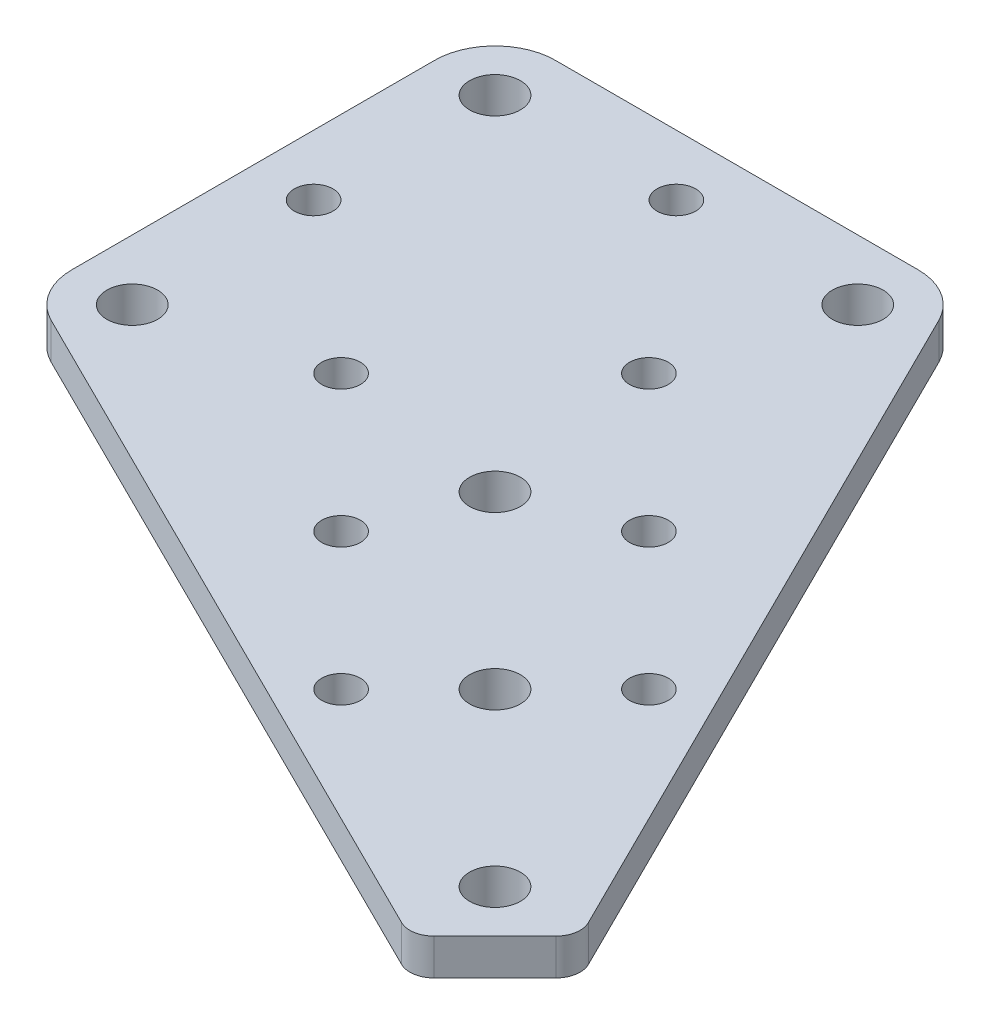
SolidWorks part; units mm, degrees
ref_plane "前视基准面" through (0, 0, 0) normal (0, 0, 1) x (1, 0, 0)
ref_plane "上视基准面" through (0, 0, 0) normal (0, 1, 0) x (1, 0, 0)
ref_plane "右视基准面" through (0, 0, 0) normal (1, 0, 0) x (0, 0, -1)
other "Configuration Table"
sketch "草图1" plane through (0, 0, 0) normal (0, 1, 0) x (1, 0, 0)
  line L0 (458.5965, -465.6676) -> (465.6676, -458.5965) construction
  line L1 (0, 0) -> (250, 0) construction
  line L2 (0, 0) -> (0, -250) construction
  line L3 (0, -250) -> (250, -250) construction
  line L4 (250, 0) -> (250, -250) construction
  line L5 (458.5965, -465.6676) -> (34.3324, -41.4035) construction
  line L6 (465.6676, -458.5965) -> (41.4035, -34.3324) construction
  line L7 (34.3324, -41.4035) -> (41.4035, -34.3324) construction
  line L8 (458.5965, -465.6676) -> (41.4035, -34.3324) construction
  line L9 (465.6676, -458.5965) -> (34.3324, -41.4035) construction
  line L10 (8, -43) -> (8, -13)
  line L11 (13, -8) -> (43, -8)
  line L12 (47.4774, -10.7746) -> (76.7588, -69.6878)
  line L13 (76.7588, -69.6878) -> (69.6878, -76.7588)
  line L14 (69.6878, -76.7588) -> (10.7746, -47.4774)
  line L15 (49.1817, -61.9096) -> (37.868, -50.5959) construction
  arc A0 (43, -8) -> (47.4774, -10.7746) centre (43, -13) cw
  arc A1 (8, -43) -> (10.7746, -47.4774) centre (13, -43) ccw
  arc A2 (8, -13) -> (13, -8) centre (13, -13) cw
  circle A3 centre (13, -13) radius 2.1
  circle A4 centre (43, -13) radius 2.1
  circle A5 centre (28, -13) radius 1.6
  circle A6 centre (13, -43) radius 2.1
  circle A7 centre (13, -28) radius 1.6
  circle A8 centre (41.4035, -41.4035) radius 2.1
  circle A9 centre (55.5456, -55.5456) radius 2.1
  circle A10 centre (69.6878, -69.6878) radius 2.1
  circle A11 centre (49.1817, -61.9096) radius 1.6
  circle A12 centre (37.868, -50.5959) radius 1.6
  circle A13 centre (26.5543, -39.2822) radius 1.6
  circle A14 centre (50.5959, -37.868) radius 1.6
  circle A15 centre (39.2822, -26.5543) radius 1.6
  circle A16 centre (61.9096, -49.1817) radius 1.6
  point P30 (46.0984, -8)
  point P33 (8, -46.0984)
  point P36 (8, -8)
  dimension "D11" = 5
  dimension "D12" = 4.2
  dimension "D16" = 4.2
  dimension "D26" = 3.2
  dimension "D1" = 250
  dimension "D2" = 250
  dimension "D3" = 10
  dimension "D4" = 45
  dimension "D5" = 600
  dimension "D6" = 8
  dimension "D7" = 8
  dimension "D8" = 30
  dimension "D9" = 30
  dimension "D10" = 50
  dimension "D13" = 15
  dimension "D14" = 15
  dimension "D15" = 3
  dimension "D17" = 5
  dimension "D18" = 5
  dimension "D19" = 20
  dimension "D22" = 16
  dimension "D23" = 25
  dimension "D24" = 4
  dimension "D25" = 4
  dimension "D27" = 25
  dimension "D20" = 3
  dimension "D21" = 2
extrude "凸台-拉伸1" add sketch "草图1" along normal blind 3
fillet "圆角1" radius 2 2 edges at (76.7588, 1.5, 69.6878) (69.6878, 1.5, 76.7588)
